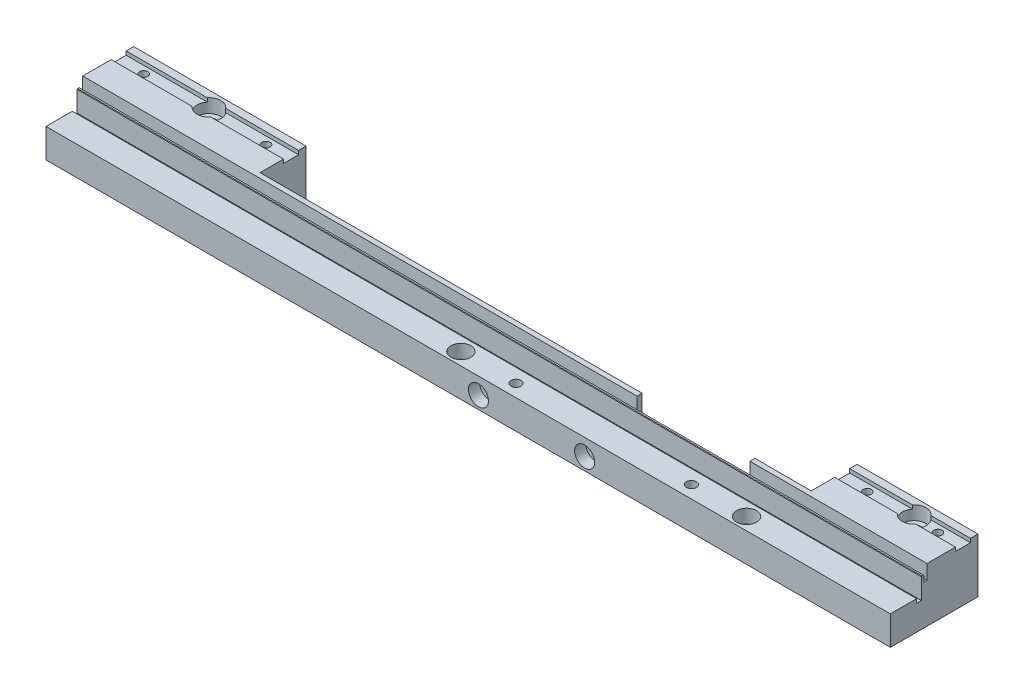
SolidWorks part; units mm, degrees
ref_plane "前视基准面" through (0, 0, 0) normal (0, 0, 1) x (1, 0, 0)
ref_plane "上视基准面" through (0, 0, 0) normal (0, 1, 0) x (1, 0, 0)
ref_plane "右视基准面" through (0, 0, 0) normal (1, 0, 0) x (0, 0, -1)
sketch "草图2" plane through (0, 0, 0) normal (0, 0, 1) x (1, 0, 0)
  line L0 (0, 0) -> (0, 21.7)
  line L1 (337, 0) -> (337, 21.7)
  line L2 (0, 0) -> (337, 0)
  line L3 (221.3, 18.4) -> (266.3, 18.4)
  line L4 (0, 21.7) -> (221.3, 21.7)
  line L5 (221.3, 18.4) -> (221.3, 21.7)
  line L6 (266.3, 18.4) -> (266.3, 21.7)
  line L7 (266.3, 21.7) -> (337, 21.7)
extrude "凸台-拉伸1" add sketch "草图2" along normal blind 35
sketch "草图3" plane through (337, 0, 0) normal (1, 0, 0) x (0, 0, -1)
  line L0 (-35, 0) -> (-35, 11.6)
  line L1 (0, 0) -> (0, 21.7)
  line L2 (-22.6, 10) -> (-22.6, 18.2)
  line L3 (-24.5, 10) -> (-24.5, 11.6)
  line L4 (-24.5, 10) -> (-22.6, 10)
  line L5 (-21.6, 15.9) -> (-21.6, 18.2)
  line L6 (-21.6, 15.9) -> (-20.36, 15.9)
  line L7 (-20.36, 15.9) -> (-20.36, 21.7)
  line L8 (-35, 0) -> (0, 0)
  line L9 (-22.4, 18.4) -> (-21.8, 18.4)
  line L10 (-21.8, 18.4) -> (-21.6, 18.2)
  line L11 (-22.4, 18.4) -> (-22.6, 18.2)
  line L12 (-35, 11.6) -> (-24.5, 11.6)
  line L13 (-20.36, 21.7) -> (-9, 21.7)
  line L14 (-9, 20.2) -> (-9, 21.7)
  line L15 (-3, 20.2) -> (-3, 21.7)
  line L16 (-9, 20.2) -> (-3, 20.2)
  line L17 (-3, 21.7) -> (0, 21.7)
extrude "切除-拉伸1" cut sketch "草图3" against normal through all flip side to cut
sketch "草图4" plane through (0, 21.7, 0) normal (0, 1, 0) x (1, 0, 0)
  line L0 (0, 0) -> (68.8, 0)
  line L1 (0, -35) -> (337, -35)
  line L2 (221.3, -20.36) -> (266.3, -20.36)
  line L3 (0, -35) -> (0, 0)
  line L4 (337, -35) -> (337, 0)
  line L5 (68.8, -18.36) -> (68.8, 0)
  line L6 (288.8, -18.36) -> (288.8, 0)
  line L7 (68.8, -18.36) -> (221.3, -18.36)
  line L8 (288.8, 0) -> (337, 0)
  line L9 (221.3, -18.36) -> (221.3, -20.36)
  line L10 (266.3, -18.36) -> (266.3, -20.36)
  line L11 (266.3, -18.36) -> (288.8, -18.36)
  circle A0 centre (36.05, -6) radius 2.75
  circle A1 centre (160.6, -30) radius 2.25
  circle A2 centre (274.6, -30) radius 2.25
  circle A3 centre (317.5, -6) radius 2.75
  circle A4 centre (58.8, -6) radius 1.65
  circle A5 centre (10, -6) radius 1.65
  circle A6 centre (298.8, -6) radius 1.65
  circle A7 centre (327, -6) radius 1.65
  circle A8 centre (182.6, -30) radius 2
  circle A9 centre (252.6, -30) radius 2
extrude "切除-拉伸2" cut sketch "草图4" against normal blind 35 flip side to cut
sketch "草图5" plane through (0, 21.7, 0) normal (0, 1, 0) x (1, 0, 0)
  circle A0 centre (36.05, -6) radius 4.75
  circle A1 centre (317.5, -6) radius 4.75
extrude "切除-拉伸3" cut sketch "草图5" against normal blind 5.5
sketch "草图6" plane through (0, 11.6, 0) normal (0, 1, 0) x (1, 0, 0)
  circle A0 centre (160.6, -30) radius 4
  circle A1 centre (274.6, -30) radius 4
extrude "切除-拉伸4" cut sketch "草图6" against normal blind 5.5
sketch "草图7" plane through (0, 0, 35) normal (0, 0, 1) x (1, 0, 0)
  circle A0 centre (215, 5) radius 2.25
  circle A1 centre (172.6, 5) radius 2.25
extrude "切除-拉伸5" cut sketch "草图7" against normal through all
sketch "草图8" plane through (0, 0, 35) normal (0, 0, 1) x (1, 0, 0)
  circle A0 centre (215, 5) radius 4
  circle A1 centre (172.6, 5) radius 4
extrude "切除-拉伸6" cut sketch "草图8" against normal blind 4.5
